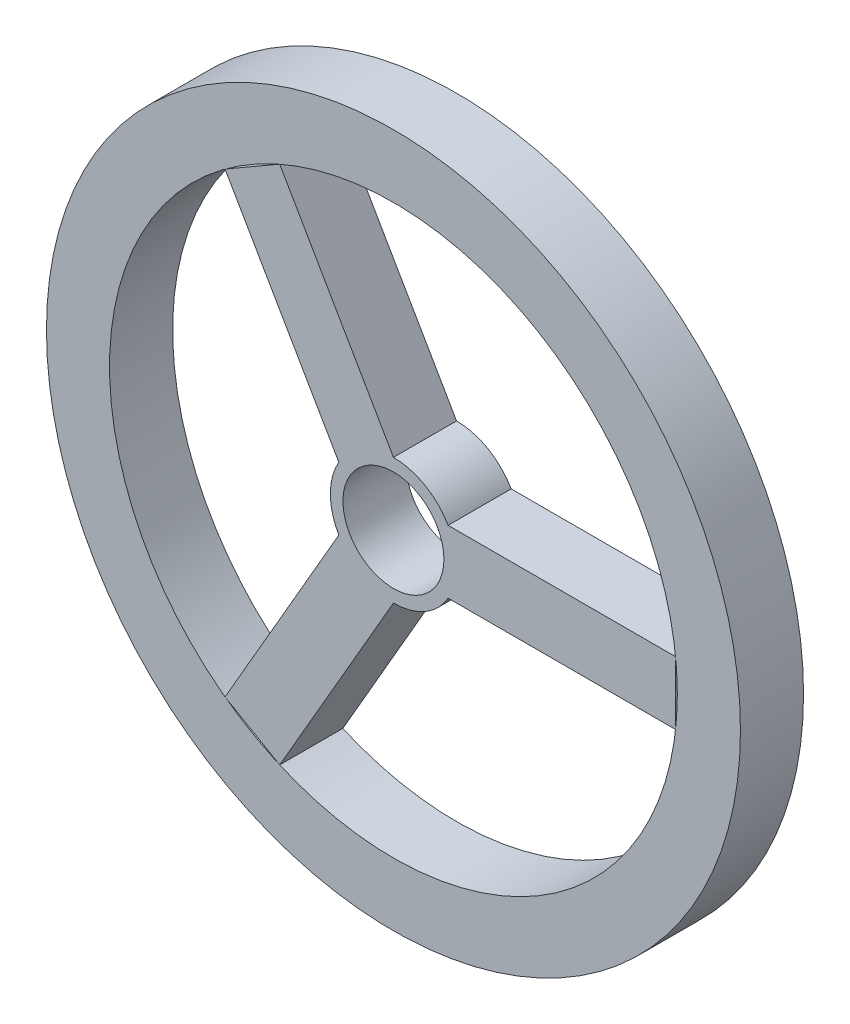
SolidWorks part; units mm, degrees
ref_plane "Plan de face" through (0, 0, 0) normal (0, 0, 1) x (1, 0, 0)
ref_plane "Plan de dessus" through (0, 0, 0) normal (0, 1, 0) x (1, 0, 0)
ref_plane "Plan de droite" through (0, 0, 0) normal (1, 0, 0) x (0, 0, -1)
sketch "Esquisse1" plane through (0, 0, 0) normal (0, 0, 1) x (1, 0, 0)
  line L0 (8.6603, 5) -> (44.7214, 5)
  line L5 (0, 0) -> (45, 0) construction
  line L6 (8.6603, -5) -> (44.7214, -5)
  line L7 (0, 0) -> (-22.5, 38.9711) construction
  line L8 (0, 10) -> (-18.0306, 41.2298)
  line L9 (-26.6908, 36.2298) -> (-8.6603, 5)
  line L10 (0, 0) -> (-22.5, -38.9711) construction
  line L11 (-26.6908, -36.2298) -> (-8.6603, -5)
  line L12 (-18.0306, -41.2298) -> (0, -10)
  line L13 (-26.6908, 36.2298) -> (-18.0306, 41.2298)
  line L14 (44.7214, 5) -> (44.7214, -5)
  line L15 (-26.6908, -36.2298) -> (-18.0306, -41.2298)
  line L16 (-8.6603, 5) -> (0, 10)
  line L17 (-8.6603, -5) -> (0, -10)
  line L18 (8.6603, 5) -> (8.6603, -5)
  circle A0 centre (0, 0) radius 55
  circle A1 centre (0, 0) radius 45
  circle A2 centre (0, 0) radius 10
  circle A3 centre (0, 0) radius 8
  dimension "D1" = 110
  dimension "D2" = 10
  dimension "D3" = 10
  dimension "D12" = 16
  dimension "D4" = 5
  dimension "D5" = 5
  dimension "D6" = 120
  dimension "D7" = 5
  dimension "D8" = 5
  dimension "D9" = 120
  dimension "D10" = 5
  dimension "D11" = 5
extrude "Boss.-Extru.1" add sketch "Esquisse1" along normal blind 10 contours A0 A1 | A2 L8 L13 L9 | A2 L6 L14 L0 | A2 L11 L15 L12 | A3
